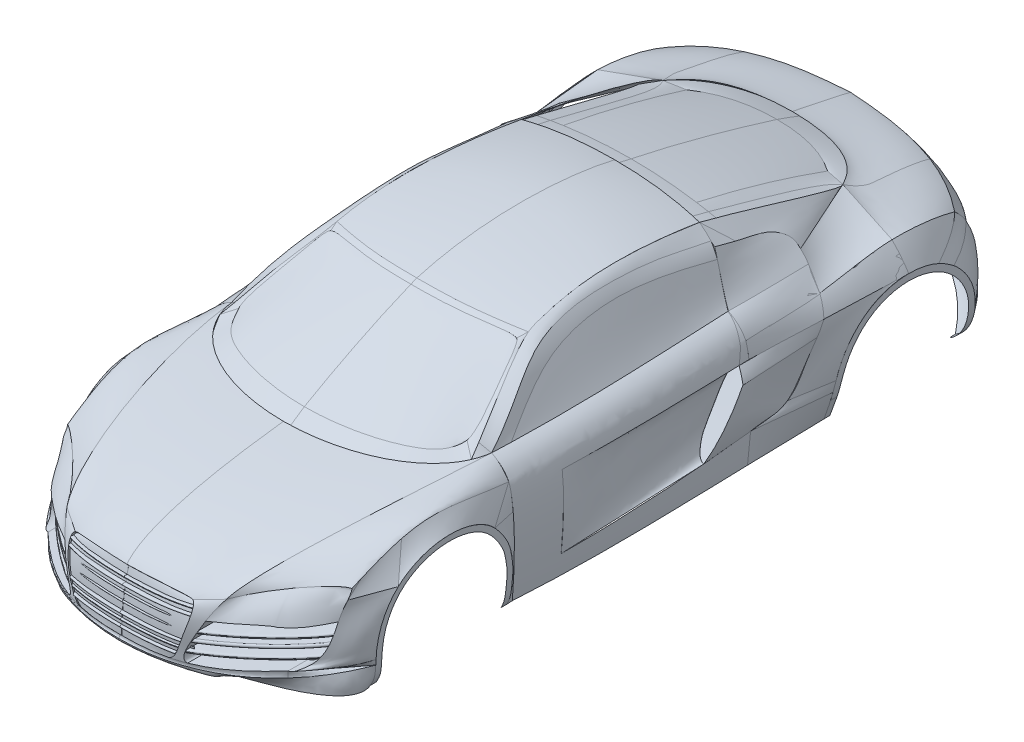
SolidWorks part; units mm, degrees
ref_plane "Front Plane" through (0, 0, 0) normal (0, 0, 1) x (1, 0, 0)
ref_plane "Top Plane" through (0, 0, 0) normal (0, 1, 0) x (1, 0, 0)
ref_plane "Right Plane" through (0, 0, 0) normal (1, 0, 0) x (0, 0, -1)
imported_body "Surface-Imported1"
imported_body "Surface-Imported2"
imported_body "Surface-Imported3"
imported_body "Surface-Imported4"
imported_body "Surface-Imported5"
imported_body "Surface-Imported6"
imported_body "Surface-Imported7"
imported_body "Surface-Imported8"
imported_body "Surface-Imported9"
imported_body "Surface-Imported10"
imported_body "Surface-Imported11"
imported_body "Surface-Imported12"
imported_body "Surface-Imported13"
imported_body "Surface-Imported14"
imported_body "Surface-Imported15"
imported_body "Surface-Imported16"
imported_body "Surface-Imported17"
imported_body "Surface-Imported18"
imported_body "Surface-Imported19"
imported_body "Surface-Imported20"
mirror "Mirror2" about plane through (0, 0, 0) normal (1, 0, 0)
